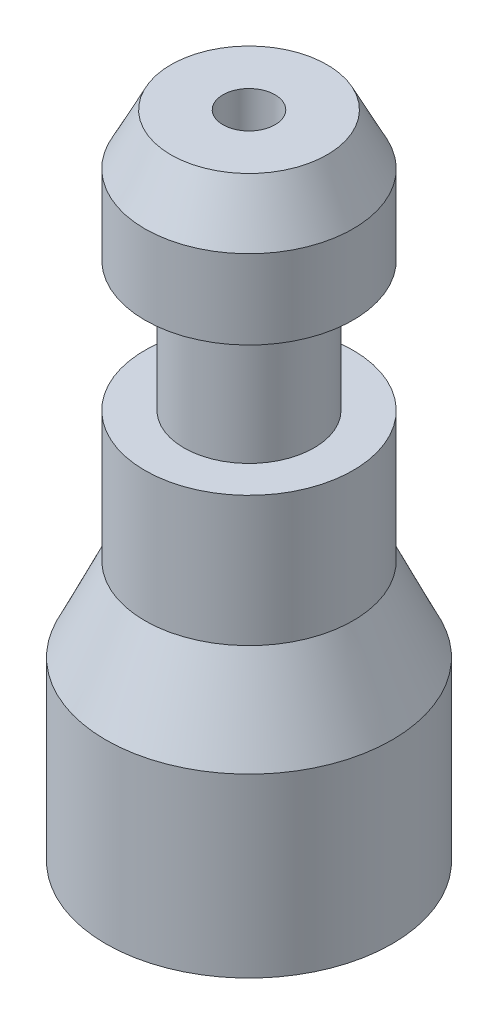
SolidWorks part; units mm, degrees
ref_plane "Front Plane" through (0, 0, 0) normal (0, 0, 1) x (1, 0, 0)
ref_plane "Top Plane" through (0, 0, 0) normal (0, 1, 0) x (1, 0, 0)
ref_plane "Right Plane" through (0, 0, 0) normal (1, 0, 0) x (0, 0, -1)
sketch "Sketch1" plane through (0, 0, 0) normal (1, 0, 0) x (0, 0, -1)
  line L0 (0, 0) -> (11, 0)
  line L1 (11, 0) -> (11, 13.57)
  line L2 (11, 13.57) -> (8, 20)
  line L3 (8, 20) -> (8, 30)
  line L4 (8, 30) -> (5, 30)
  line L5 (5, 30) -> (5, 40)
  line L6 (5, 40) -> (8, 40)
  line L7 (8, 40) -> (8, 46.0756)
  line L8 (8, 46.0756) -> (6, 50)
  line L9 (6, 50) -> (2, 50)
  line L10 (2, 50) -> (2, 5.82)
  line L11 (2, 5.82) -> (0, 5.82)
  line L12 (0, 5.82) -> (0, 0)
  dimension "D1" = 11
  dimension "D2" = 13.57
  dimension "D3" = 10
  dimension "D4" = 10
  dimension "D5" = 50
  dimension "D6" = 10
  dimension "D7" = 44.18
  dimension "D8" = 4
  dimension "D9" = 3
  dimension "D10" = 6
  dimension "D11" = 6
  dimension "D12" = 2
revolve "Revolve1" add sketch "Sketch1" angle 360 about L12
